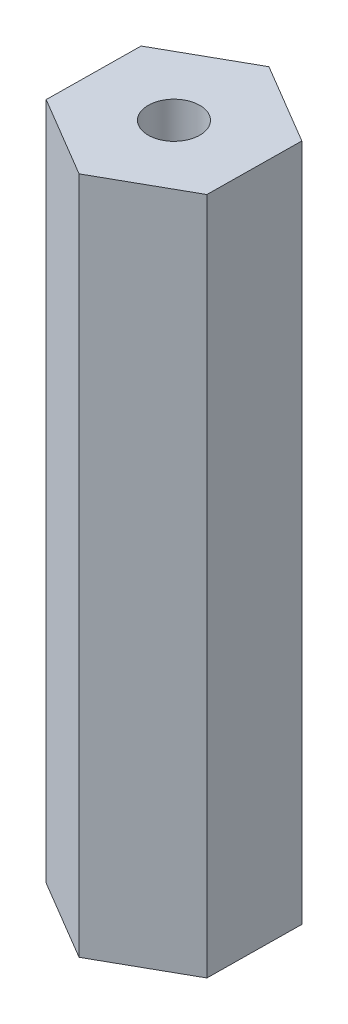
SolidWorks part; units mm, degrees
ref_plane "Front Plane" through (0, 0, 0) normal (0, 0, 1) x (1, 0, 0)
ref_plane "Top Plane" through (0, 0, 0) normal (0, 1, 0) x (1, 0, 0)
ref_plane "Right Plane" through (0, 0, 0) normal (1, 0, 0) x (0, 0, -1)
sketch "Sketch2" plane through (0, 0, 0) normal (0, 1, 0) x (1, 0, 0)
  line L1 (6.3075, -3.7389) -> (6.3917, 3.593)
  line L2 (6.3917, 3.593) -> (0.0842, 7.3319)
  line L3 (0.0842, 7.3319) -> (-6.3075, 3.7389)
  line L4 (-6.3075, 3.7389) -> (-6.3917, -3.593)
  line L5 (-6.3917, -3.593) -> (-0.0842, -7.3319)
  line L6 (-0.0842, -7.3319) -> (6.3075, -3.7389)
  circle A0 centre (0, 0) radius 6.35 construction
  circle A1 centre (0, 0) radius 2.0193
  dimension "D2" = 4.0386
  dimension "D1" = 12.7
extrude "Boss-Extrude4" add sketch "Sketch2" along normal blind 52.9971
